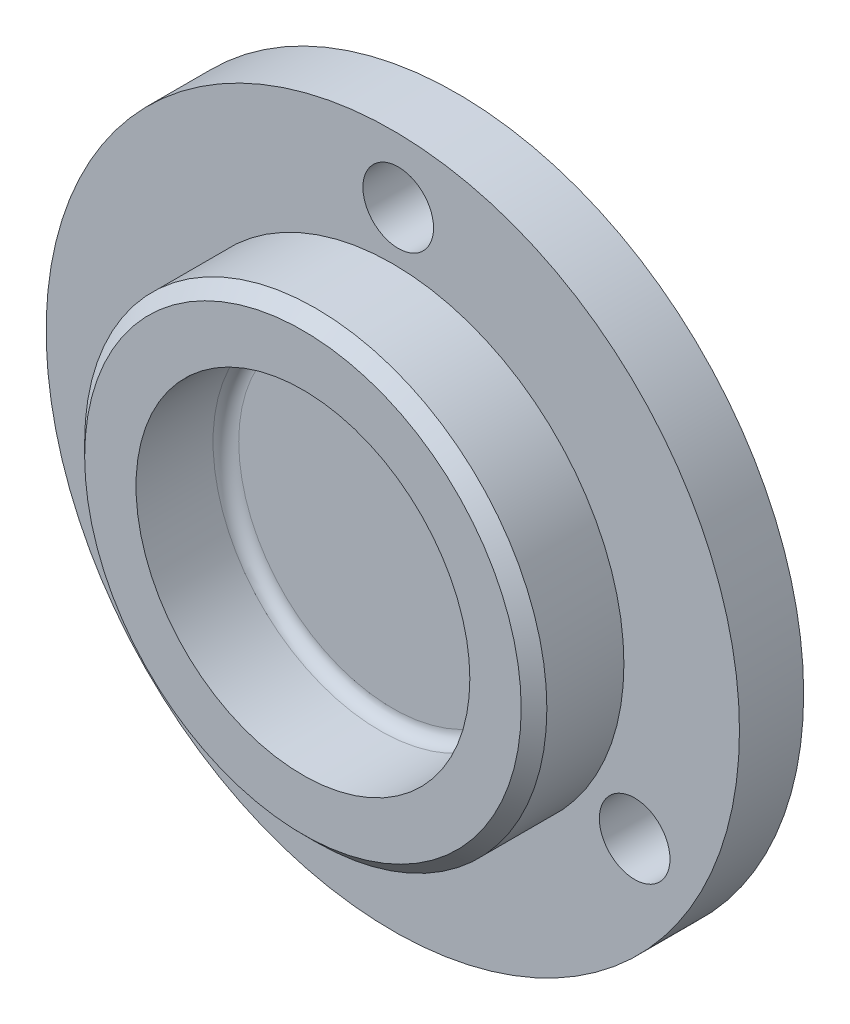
SolidWorks part; units mm, degrees
ref_plane "Plan de face" through (0, 0, 0) normal (0, 0, 1) x (1, 0, 0)
ref_plane "Plan de dessus" through (0, 0, 0) normal (0, 1, 0) x (1, 0, 0)
ref_plane "Plan de droite" through (0, 0, 0) normal (1, 0, 0) x (0, 0, -1)
sketch "Esquisse1" plane through (0, 0, 0) normal (0, 0, 1) x (1, 0, 0)
  circle A0 centre (0, 0) radius 27
  dimension "D1" = 54
extrude "Extrusion1" add sketch "Esquisse1" along normal blind 5
sketch "Esquisse2" plane through (0, 0, 5) normal (0, 0, 1) x (1, 0, 0)
  circle A0 centre (0, 0) radius 18
  dimension "D1" = 36
extrude "Extrusion2" add sketch "Esquisse2" along normal blind 7
sketch "Esquisse3" plane through (0, 0, 12) normal (0, 0, 1) x (1, 0, 0)
  circle A0 centre (0, 0) radius 13
  dimension "D1" = 26
extrude "Enlèv. mat.-Extru.2" cut sketch "Esquisse3" against normal blind 7
fillet "Congé1" radius 1 1 edges at (13, 0, 5)
hole_wizard "Dégagement M51" positions "Esquisse3D1" profile "Esquisse4" hole size "M5" standard "ISO"
sketch3d "Esquisse3D1"
  line L0 (0, 0, 0) -> (0.5848, 30.4108, 0) construction
  point P0 (0.423, 21.9959, 0)
  dimension "D1" = 22
sketch "Esquisse4" plane through (0.423, 21.9959, 0) normal (1, 0, 0) x (0, 1, 0)
  line L0 (0, 0) -> (0, 12)
  line L1 (0, 12) -> (2.75, 12)
  line L2 (2.75, 12) -> (2.75, 0)
  line L5 (2.75, 0) -> (0, 0)
  line L11 (0, -6.35) -> (0, 107.95) construction
  dimension "Diamètre du perçage jusqu'au prochain" = 5.5
  dimension "Profondeur du perçage jusqu'au prochain" = 12
pattern_circular "Répétition circulaire1" count 3 every 120 about axis through (0, 0, 0) along (0, 0, 1) of "Dégagement M51"
chamfer "Chanfrein1" distance 1 angle 45 1 edges at (18, 0, 12)
